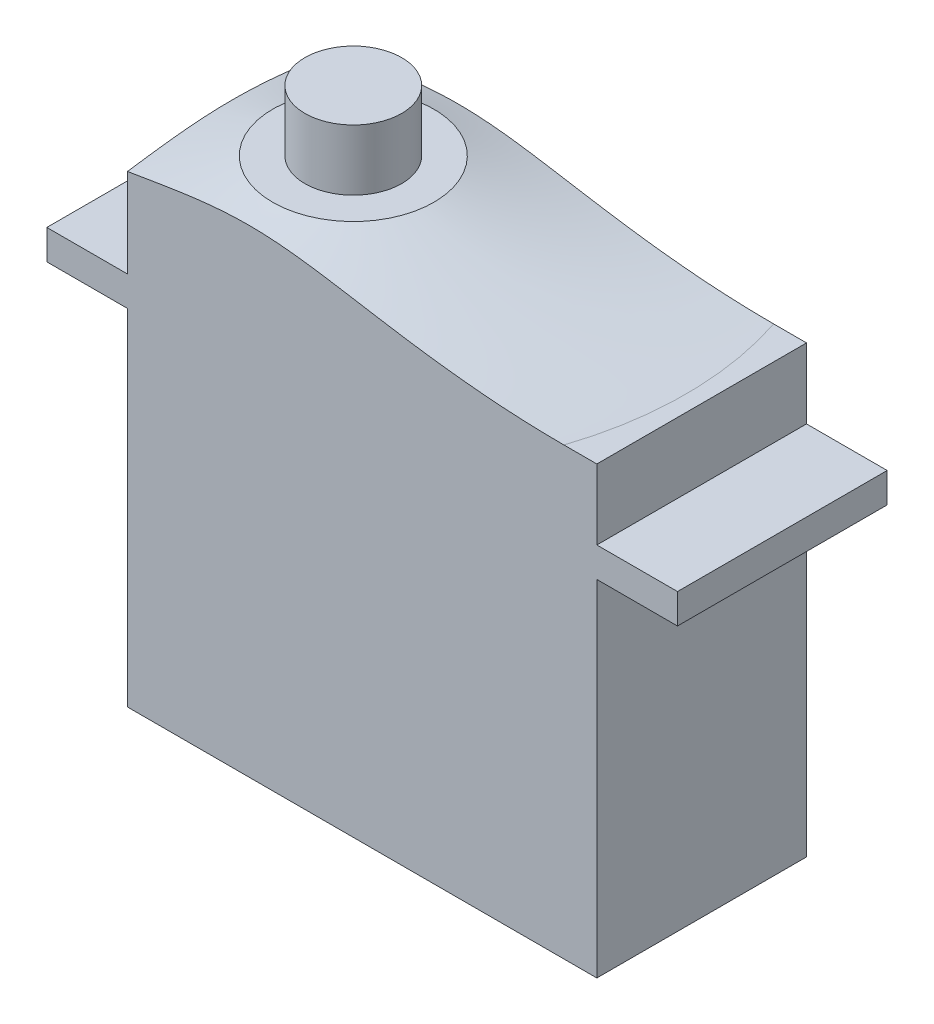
SolidWorks part; units mm, degrees
ref_plane "Front Plane" through (0, 0, 0) normal (0, 0, 1) x (1, 0, 0)
ref_plane "Top Plane" through (0, 0, 0) normal (0, 1, 0) x (1, 0, 0)
ref_plane "Right Plane" through (0, 0, 0) normal (1, 0, 0) x (0, 0, -1)
sketch "Sketch1" plane through (0, 0, 0) normal (0, 1, 0) x (1, 0, 0)
  line L1 (0, 0) -> (29.1, 0)
  line L2 (0, 0) -> (0, -13)
  line L3 (0, -13) -> (29.1, -13)
  line L4 (29.1, 0) -> (29.1, -13)
  dimension "D1" = 13
  dimension "D2" = 29.1
extrude "Boss-Extrude1" add sketch "Sketch1" along normal blind 27.6 contours L1 L4 L3 L2
sketch "Sketch2" plane through (29.1, 0, 0) normal (1, 0, 0) x (0, 0, -1)
  line L0 (-13, 0) -> (-13, 21.4) construction
  line L1 (-13, 27.6) -> (-13, 0) construction
  line L2 (0, 27.6) -> (0, 0) construction
  line L3 (-13, 21.4) -> (0, 21.4)
  line L4 (-13, 21.4) -> (-13, 23.25)
  line L5 (-13, 23.25) -> (0, 23.25)
  line L6 (0, 21.4) -> (0, 23.25)
  dimension "D1" = 21.4
  dimension "D2" = 1.85
extrude "Boss-Extrude2" add sketch "Sketch2" along normal blind 5
sketch "Sketch3" plane through (0, 0, 0) normal (-1, 0, 0) x (0, 0, 1)
  line L0 (13, 0) -> (13, 21.4) construction
  line L1 (13, 27.6) -> (13, 0) construction
  line L2 (13, 21.4) -> (13, 0) construction
  line L3 (0, 27.6) -> (0, 0) construction
  line L4 (13, 21.4) -> (0, 21.4)
  line L5 (13, 21.4) -> (13, 23.25)
  line L6 (13, 23.25) -> (0, 23.25)
  line L7 (0, 21.4) -> (0, 23.25)
  line L8 (13, 23.25) -> (13, 21.4) construction
extrude "Boss-Extrude3" add sketch "Sketch3" along normal blind 5
sketch "Sketch4" plane through (0, 27.6, 0) normal (0, 1, 0) x (1, 0, 0)
  line L0 (0, -6.5) -> (7.5, -6.5) construction
  line L1 (0, 0) -> (0, -13) construction
  circle A0 centre (7.5, -6.5) radius 5
  dimension "D2" = 10
  dimension "D1" = 7.5
  dimension "D3" = 6.5
extrude "Boss-Extrude4" add sketch "Sketch4" along normal blind 2.5
sketch "Sketch5" plane through (0, 30.1, 0) normal (0, 1, 0) x (1, 0, 0)
  circle A0 centre (7.5, -6.5) radius 3
  dimension "D1" = 6
extrude "Boss-Extrude5" add sketch "Sketch5" along normal blind 3.77
fillet "Fillet1" radius 50 1 edges at (7.5, 27.6, 11.5)
sketch "Sketch6" plane through (0, 33.87, 0) normal (0, 1, 0) x (1, 0, 0)
  line L0 (7.5, -6.5) -> (10.5, -6.5) construction
  circle A0 centre (7.5, -6.5) radius 3 construction
